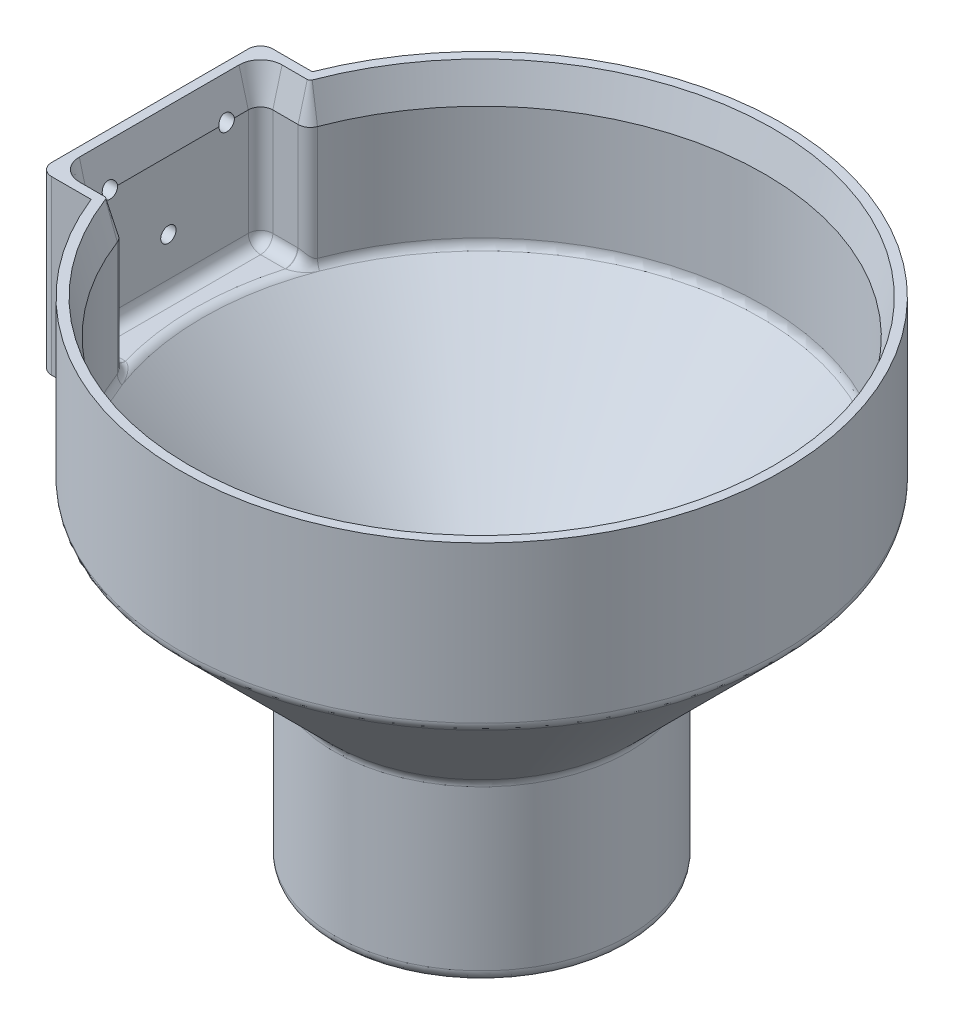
SolidWorks part; units mm, degrees
ref_plane "Front Plane" through (0, 0, 0) normal (0, 0, 1) x (1, 0, 0)
ref_plane "Top Plane" through (0, 0, 0) normal (0, 1, 0) x (1, 0, 0)
ref_plane "Right Plane" through (0, 0, 0) normal (1, 0, 0) x (0, 0, -1)
sketch "Sketch1" plane through (0, 0, 0) normal (0, 0, 1) x (1, 0, 0)
  line L0 (0, 0) -> (0, 32.6373) construction
  line L1 (0, 0) -> (-46, 0)
  line L2 (-46, 0) -> (-46, -25)
  line L3 (-46, -25) -> (-21, -50)
  line L4 (-21, -50) -> (-21, -80)
  line L5 (-21, -80) -> (0, -80)
  line L6 (0, -80) -> (0, 0)
  dimension "D1" = 21
  dimension "D2" = 25
  dimension "D3" = 80
  dimension "D4" = 30
  dimension "D5" = 46
revolve "Revolve1" add sketch "Sketch1" angle 360 about L0
sketch "Sketch3" plane through (0, 0, 0) normal (0, 0, 1) x (1, 0, 0)
  line L0 (46, -25) -> (-46, -25) construction
  line L1 (-51, -25) -> (0, -25)
  line L2 (-51, -25) -> (-51, 0)
  line L3 (-51, 0) -> (0, 0)
  line L4 (0, -25) -> (0, 0)
  dimension "D1" = 51
extrude "Boss-Extrude1" add sketch "Sketch3" along normal mid plane 30
shell "Shell1" thickness 3
fillet "Fillet1" radius 2 15 edges at (-46, -25, 0) (-47.2428, -25, 15) (-51, -25, 0) (-47.2428, -25, -15) (46, -25, 0) (21, -50, 0) (-24, -80, 0) (-24, -51.2426, 0) (49, -26.2426, 0) (-54, -14, -18) (-54, -14, 18) (-43.4856, -12.5, 15) (-51, -12.5, 15) (-51, -12.5, -15) (-43.4856, -12.5, -15)
chamfer "Chamfer1" distance 2.5 angle 75 1 edges at (21, -80, 0)
chamfer "Chamfer2" distance 1.5 angle 75 8 edges at (-51, 0, 0) (-50.4142, 0, -14.4142) (-50.4142, 0, 14.4142) (-46.9444, 0, -15) (-46.9444, 0, 15) (-43.7522, 0, -15.3543) (-43.7522, 0, 15.3543) (46, 0, 0)
sketch "Sketch6" plane through (-54, 0, 0) normal (-1, 0, 0) x (0, 0, 1)
  line L0 (0, 0) -> (0, -28) construction
  line L1 (-16, 0) -> (16, -28) construction
  line L2 (-18, -28) -> (18, -28) construction
  line L3 (16, -28) -> (16, 0) construction
  circle A0 centre (0, -16.642) radius 1.25
  circle A1 centre (-9.5, -5.6875) radius 1.25
  circle A2 centre (9.5, -5.6875) radius 1.25
  point P6 (15.9873, -28)
  point P11 (0, 0)
  point P12 (16, -28)
  point P23 (0, 0)
  dimension "D1" = 2.5
  dimension "D2" = 19
  dimension "D3" = 14.5
extrude "Cut-Extrude1" cut sketch "Sketch6" against normal up to next
